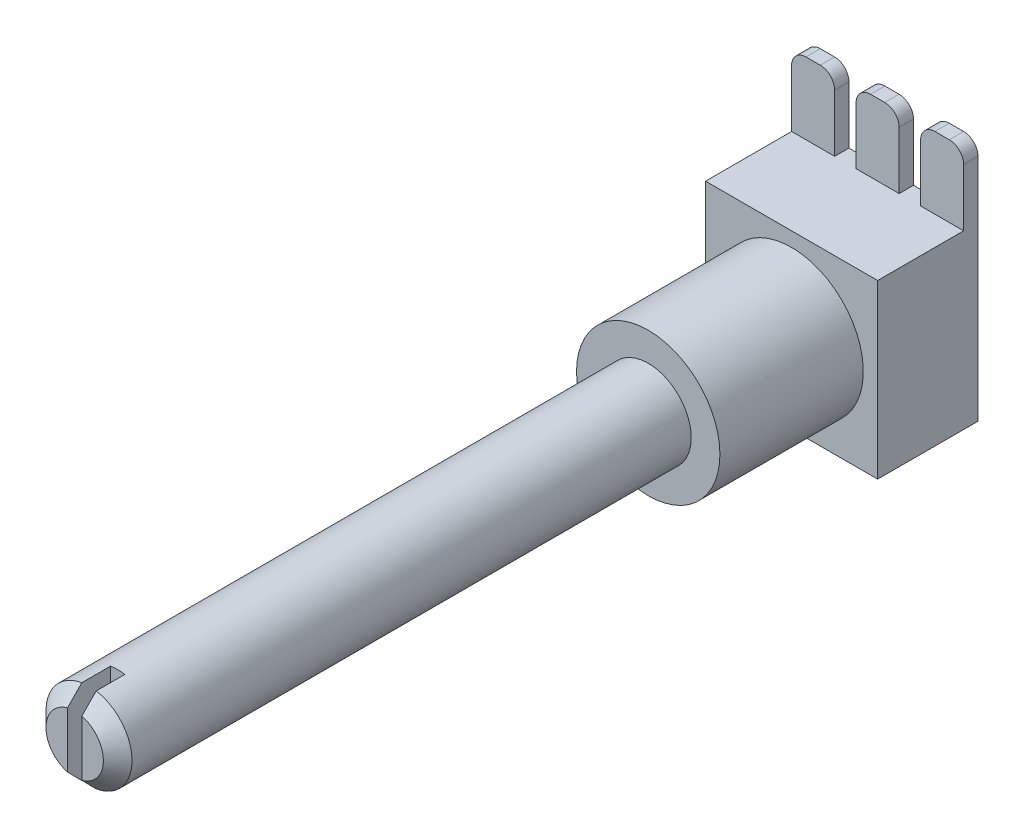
SolidWorks part; units mm, degrees
ref_plane "Plan1" through (0, 0, 0) normal (0, 0, 1) x (1, 0, 0)
ref_plane "Plan2" through (0, 0, 0) normal (0, 1, 0) x (1, 0, 0)
ref_plane "Plan3" through (0, 0, 0) normal (1, 0, 0) x (0, 0, -1)
sketch "Esquisse1" plane through (0, 0, 0) normal (0, 0, 1) x (1, 0, 0)
  line L0 (-6, 12) -> (6, 12)
  line L1 (-6, 12) -> (-6, 0)
  line L2 (6, 0) -> (-6, 0)
  line L3 (6, 0) -> (6, 12)
  dimension "D2" = 12
extrude "Base-Extrusion" add sketch "Esquisse1" along normal blind 7
sketch "Esquisse2" plane through (0, 0, 7) normal (0, 0, 1) x (1, 0, 0)
  circle A0 centre (0, 6) radius 5
  dimension "D1" = 10
  dimension "D2" = 6
extrude "Boss.-Extru.1" add sketch "Esquisse2" along normal blind 10
sketch "Esquisse3" plane through (0, 0, 17) normal (0, 0, 1) x (1, 0, 0)
  circle A0 centre (0, 6) radius 3
  dimension "D1" = 6
extrude "Boss.-Extru.2" add sketch "Esquisse3" along normal blind 40
sketch "Esquisse4" plane through (0, 0, 0) normal (0, 0, -1) x (-1, 0, 0)
  line L0 (-6, 12) -> (-3, 12)
  line L1 (-6, 12) -> (-6, 16)
  line L2 (1.5, 16) -> (1.5, 12)
  line L3 (-3, 16) -> (-3, 12)
  line L4 (1.5, 12) -> (-1.5, 12)
  line L5 (0.5, 17) -> (-0.5, 17)
  line L6 (-1.5, 12) -> (-1.5, 16)
  line L7 (-4, 17) -> (-5, 17)
  line L8 (6, 12) -> (-6, 12) construction
  line L9 (3, 12) -> (6, 12)
  line L10 (3, 12) -> (3, 16)
  line L11 (5, 17) -> (4, 17)
  line L12 (6, 16) -> (6, 12)
  arc A0 (1.5, 16) -> (0.5, 17) centre (0.5, 16) ccw
  arc A1 (-3, 16) -> (-4, 17) centre (-4, 16) ccw
  arc A2 (-6, 16) -> (-5, 17) centre (-5, 16) cw
  arc A3 (-1.5, 16) -> (-0.5, 17) centre (-0.5, 16) cw
  arc A4 (3, 16) -> (4, 17) centre (4, 16) cw
  arc A5 (6, 16) -> (5, 17) centre (5, 16) ccw
  point P26 (3, 20)
  point P29 (6, 20)
  dimension "D1" = 1
  dimension "D2" = 3
  dimension "D3" = 1.5
extrude "Boss.-Extru.4" add sketch "Esquisse4" against normal blind 1
chamfer "Chanfrein1" distance 1 angle 45
sketch "Esquisse5" plane through (0, 0, 57) normal (0, 0, 1) x (1, 0, 0)
  line L1 (-0.5, 10.3182) -> (0.5, 10.3182)
  line L2 (-0.5, 10.3182) -> (-0.5, 1.404)
  line L3 (-0.5, 1.404) -> (0.5, 1.404)
  line L4 (0.5, 10.3182) -> (0.5, 1.404)
  dimension "D1" = 0.5
  dimension "D2" = 1
extrude "Enlèv. mat.-Extru.1" cut sketch "Esquisse5" against normal blind 3
